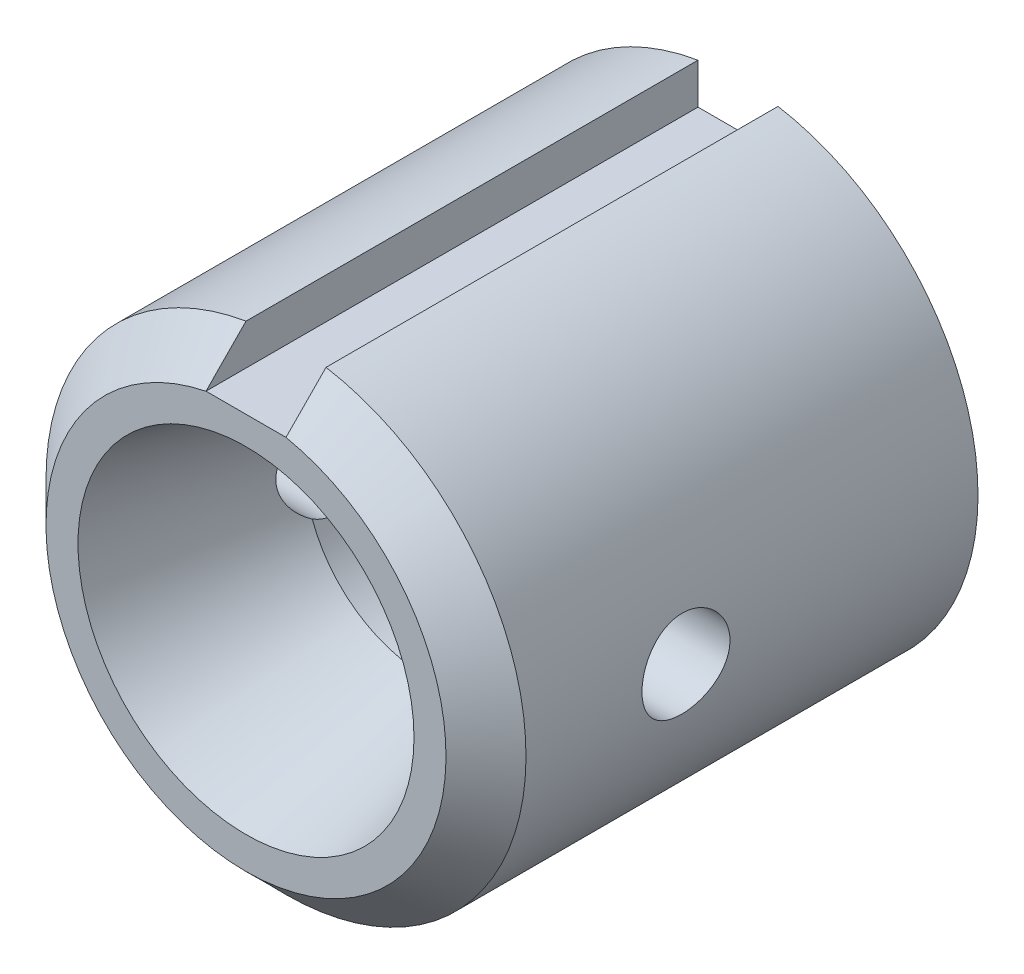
SolidWorks part; units mm, degrees
ref_plane "Front Plane" through (0, 0, 0) normal (0, 0, 1) x (1, 0, 0)
ref_plane "Top Plane" through (0, 0, 0) normal (0, 1, 0) x (1, 0, 0)
ref_plane "Right Plane" through (0, 0, 0) normal (1, 0, 0) x (0, 0, -1)
ref_plane "Plane1" through (0, 295, 0) normal (0, 1, 0) x (-1, 0, 0)
sketch "Sketch1" plane through (0, 295, 0) normal (0, 1, 0) x (-1, 0, 0)
  line L0 (-66, 6.7) -> (-60, 6.7)
  line L1 (-60, 6.7) -> (-60, 19)
  line L2 (-60, 19) -> (-66, 19)
  line L3 (-66, 19) -> (-66, 6.7)
  line L4 (-60, 6.7) -> (-60, 19) construction
revolve "Revolve1" add sketch "Sketch1" angle 360 about L4
sketch "Sketch2" plane through (0, 0, 6.7) normal (0, 0, -1) x (-1, 0, 0)
  line L0 (-61, 300.9161) -> (-61, 299.9)
  line L1 (-61, 299.9) -> (-59, 299.9)
  line L2 (-59, 299.9) -> (-59, 300.9161)
  arc A0 (-59, 300.9161) -> (-61, 300.9161) centre (-60, 295) ccw
  dimension "D1" = 2
extrude "Extrude1" cut sketch "Sketch2" against normal through all
hole_wizard "Hole1" positions "Sketch4" profile "Sketch3" legacy
sketch "Sketch4" plane through (0, 0, 6.7) normal (0, 0, -1) x (-1, 0, 0)
  point P0 (-60, 295)
sketch "Sketch3" plane through (60, 295, 6.7) normal (1, 0, 0) x (0, 1, 0)
  line L0 (0, 0) -> (0, 12.3)
  line L1 (0, 12.3) -> (3, 12.3)
  line L2 (3, 12.3) -> (3, 0)
  line L3 (3, 0) -> (0, 0)
  line L4 (0, 110) -> (0, -10) construction
  dimension "Diameter" = 6
  dimension "Depth" = 12.3
chamfer "Chamfer1" distance 1 angle 45 1 edges at (60, 289, 19)
sketch "Sketch5" plane through (0, 0, 0) normal (1, 0, 0) x (0, 0, -1)
  line L0 (-19, 294.95) -> (-14, 294.95) construction
  line L1 (-19, 299.9) -> (-19, 290) construction
  circle A0 centre (-14, 294.95) radius 1.1
  dimension "D2" = 2.2
  dimension "D1" = 5
extrude "Extrude3" cut sketch "Sketch5" along normal blind 80
sketch "Sketch6" plane through (0, 0, 19) normal (0, 0, 1) x (1, 0, 0)
  circle A0 centre (60, 295) radius 4.2
  circle A1 centre (60, 295) radius 3 construction
  dimension "D1" = 8.4
extrude "Extrude4" cut sketch "Sketch6" against normal blind 10 draft 15
